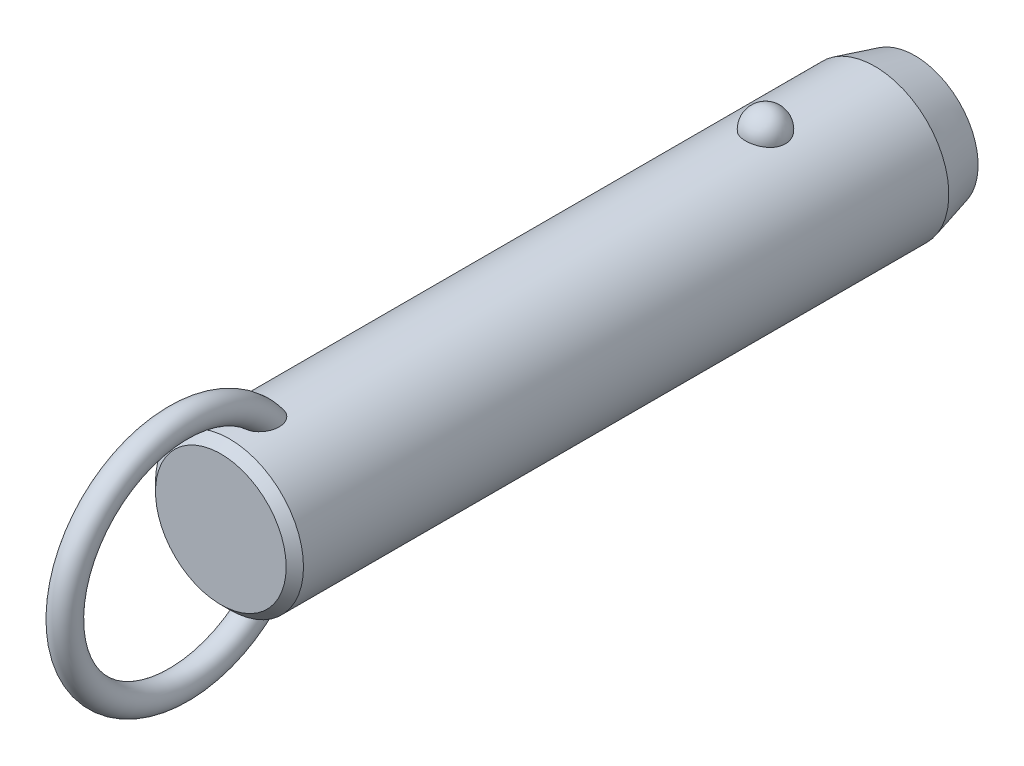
SolidWorks part; units mm, degrees
ref_plane "Front Plane" through (0, 0, 0) normal (0, 0, 1) x (1, 0, 0)
ref_plane "Top Plane" through (0, 0, 0) normal (0, 1, 0) x (1, 0, 0)
ref_plane "Right Plane" through (0, 0, 0) normal (1, 0, 0) x (0, 0, -1)
sketch "Sketch2" plane through (0, 0, 0) normal (0, 0, 1) x (1, 0, 0)
  circle A0 centre (0, 0) radius 11.1
  point P3 (0, 11.1)
  dimension "D1" = 22.2
extrude "Boss-Extrude1" add sketch "Sketch2" along normal blind 66
sketch "Sketch3" plane through (0, 0, 0) normal (0, 0, -1) x (-1, 0, 0)
  circle A0 centre (0, 0) radius 11.1
  dimension "D1" = 22.2
extrude "Boss-Extrude2" add sketch "Sketch3" along normal blind 25.4
chamfer "Chamfer1" distance 6 angle 15 1 edges at (-11.1, 0, -25.4)
sketch "Sketch12" plane through (0, 0, 0) normal (1, 0, 0) x (0, 0, -1)
  line L0 (-66, 11.1) -> (-66, -11.1) construction
  point P0 (-66, 0)
sketch "Sketch13" plane through (0, 0, 0) normal (1, 0, 0) x (0, 0, -1)
  circle A0 centre (-85.05, 0) radius 19.05
  point P2 (-66, 0)
  dimension "D1" = 38.1
sketch "Sketch14" plane through (0, 0, 0) normal (0, 1, 0) x (1, 0, 0)
  circle A0 centre (0, -68) radius 2
  point P2 (0, -66)
  dimension "D1" = 4
sweep "Sweep1" add profiles "Sketch14" path "Sketch13"
sketch "Sketch15" plane through (0, 0, 66) normal (0, 0, 1) x (1, 0, 0)
  circle A0 centre (0, 0) radius 11.1
  dimension "D1" = 22.2
extrude "Boss-Extrude3" add sketch "Sketch15" along normal blind 12.7
chamfer "Chamfer2" distance 1.3 angle 45 1 edges at (11.1, 0, 78.7)
sketch "Sketch18" plane through (0, 0, 0) normal (1, 0, 0) x (0, 0, -1)
  line L0 (19.4, 11.1) -> (-69.568, 11.1) construction
  line L1 (3, 14.1) -> (3, 8.1)
  line L2 (-69.568, -11.1) -> (19.4, -11.1) construction
  arc A0 (3, 14.1) -> (3, 8.1) centre (3, 11.1) ccw
  point P4 (0, 11.1)
  dimension "D1" = 25.2
revolve "Revolve1" add sketch "Sketch18" angle 360 about L1
